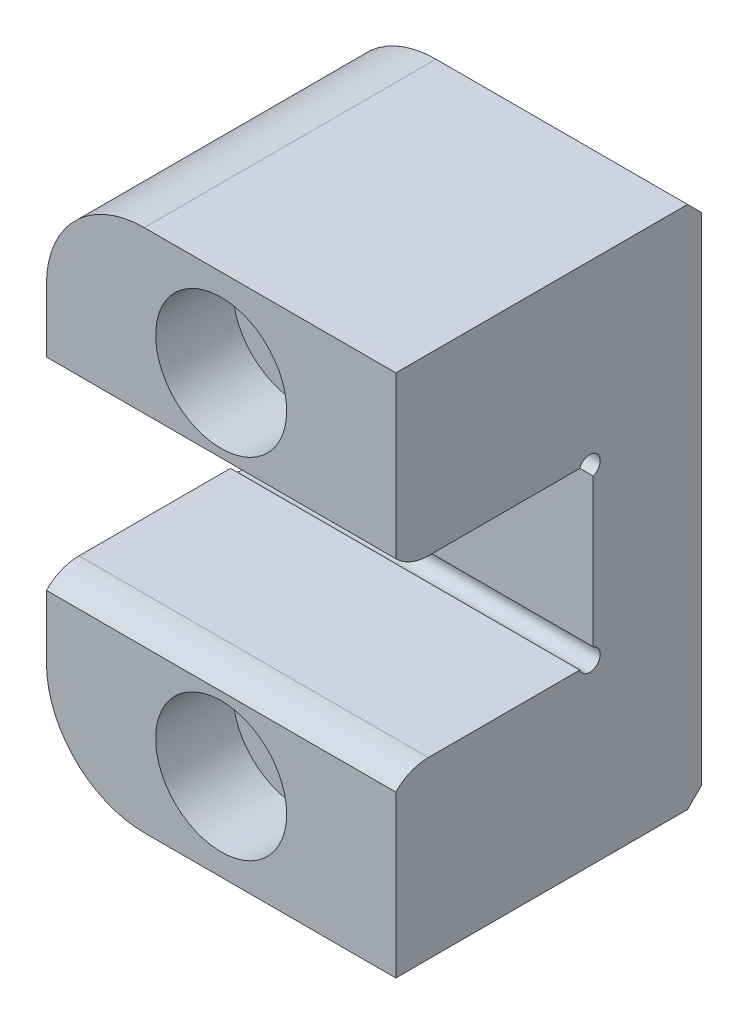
SolidWorks part; units mm, degrees
ref_plane "Front Plane" through (0, 0, 0) normal (0, 0, 1) x (1, 0, 0)
ref_plane "Top Plane" through (0, 0, 0) normal (0, 1, 0) x (1, 0, 0)
ref_plane "Right Plane" through (0, 0, 0) normal (1, 0, 0) x (0, 0, -1)
sketch "Sketch1" plane through (0, 0, 0) normal (1, 0, 0) x (0, 0, -1)
  line L0 (0, 0) -> (50000, 0) construction
  line L1 (0, 6.35) -> (14.351, 6.35)
  line L2 (0, 19.05) -> (22.225, 19.05)
  line L3 (0, 19.05) -> (0, 6.35)
  line L4 (0, -19.05) -> (22.225, -19.05)
  line L5 (22.225, 19.05) -> (22.225, -19.05)
  line L6 (14.351, 6.35) -> (14.351, -6.35)
  line L7 (14.351, -6.35) -> (0, -6.35)
  line L9 (0, 10.4775) -> (0, -10.4775) construction
  line L10 (0, -6.35) -> (0, -19.05)
  dimension "D1" = 22.225
  dimension "D2" = 38.1
  dimension "D3" = 14.351
  dimension "D4" = 12.7
extrude "Extrude1" add sketch "Sketch1" along normal mid plane 25.4
fillet "Fillet1" radius 7.112 2 edges at (-12.7, -19.05, -11.1125) (-12.7, 19.05, -11.1125)
sketch "Sketch2" plane through (-9.525, 0, -22.225) normal (0, 0, 1) x (1, 0, 0)
  line L0 (0, 0) -> (50000, 0) construction
  line L1 (22.225, -19.05) -> (22.225, 19.05) construction
  line L2 (20.6375, 3.846) -> (23.8125, 5.679) construction
  line L3 (20.6375, 3.846) -> (20.6375, -3.846) construction
  line L4 (20.6375, -3.846) -> (23.8125, -5.679) construction
  line L5 (23.8125, 5.679) -> (23.8125, -5.679) construction
  line L6 (9.525, 0) -> (9.525, 50000) construction
  line L7 (-4.7625, 5.679) -> (-4.7625, -5.679)
  line L8 (-1.5875, -3.846) -> (-4.7625, -5.679)
  line L9 (-1.5875, 3.846) -> (-1.5875, -3.846)
  line L10 (-1.5875, 3.846) -> (-4.7625, 5.679)
  point P4 (22.225, 4.7625)
  point P10 (22.225, -4.7625)
  point P13 (-3.175, -4.7625)
  point P14 (-3.175, 4.7625)
  dimension "D1" = 9.525
  dimension "D2" = 1.5875
  dimension "D3" = 30
  dimension "D4" = 3.175
extrude "Cut-Extrude1" cut sketch "Sketch2" along normal through all
sketch "Sketch5" plane through (12.7, 0, 0) normal (1, 0, 0) x (0, 0, -1)
  line L0 (0, 0) -> (50000, 0) construction
  line L1 (0, 6.35) -> (14.351, 6.35) construction
  line L2 (0, 19.05) -> (0, 6.35) construction
  line L3 (0, -6.35) -> (0, -19.05) construction
  line L4 (-3.9878, -4.171) -> (2.3622, -4.171)
  line L5 (-3.9878, -4.171) -> (-3.9878, -7.346)
  line L6 (-3.9878, -7.346) -> (0, -7.346)
  line L7 (2.3622, -4.171) -> (2.3622, -6.35)
  line L8 (14.351, -6.35) -> (0, -6.35) construction
  line L9 (2.3622, 4.171) -> (2.3622, 6.35)
  line L10 (-3.9878, 7.346) -> (0, 7.346)
  line L11 (-3.9878, 4.171) -> (-3.9878, 7.346)
  line L12 (-3.9878, 4.171) -> (2.3622, 4.171)
  arc A0 (0.5438, -6.6159) -> (2.3622, -6.35) centre (2.3622, -12.7) cw construction
  arc A1 (0, -7.346) -> (0.5438, -6.6159) centre (0.762, -7.346) cw construction
  arc A2 (0, 7.346) -> (0.5438, 6.6159) centre (0.762, 7.346) ccw construction
  arc A3 (0.5438, 6.6159) -> (2.3622, 6.35) centre (2.3622, 12.7) ccw construction
  arc A4 (0, 7.346) -> (2.3622, 6.35) centre (2.3622, 9.6492) ccw
  arc A5 (0, -7.346) -> (2.3622, -6.35) centre (2.3622, -9.6492) cw
  dimension "D1" = 0.762
  dimension "D2" = 6.35
  dimension "D3" = 3.175
  dimension "D4" = 6.35
  dimension "D5" = 2.3622
extrude "Cut-Extrude2" cut sketch "Sketch5" against normal through all
sketch "Sketch6" plane through (12.7, 0, 0) normal (1, 0, 0) x (0, 0, -1)
  line L0 (0, 0) -> (50000, 0) construction
  line L3 (14.351, 6.35) -> (14.351, -6.35) construction
  line L4 (2.3622, 6.35) -> (14.351, 6.35) construction
  circle A0 centre (14.097, 6.096) radius 0.762
  circle A1 centre (14.097, -6.096) radius 0.762
  dimension "D2" = 0.508
  dimension "D3" = 0.762
  dimension "D1" = 0.508
extrude "Cut-Extrude3" cut sketch "Sketch6" against normal through all
hole_wizard "#10 CBORE" positions "Sketch4" profile "Sketch3" counterbore size "#10" standard "Ansi Inch"
sketch "Sketch4" plane through (0, 0, 0) normal (0, 0, 1) x (1, 0, 0)
  line L0 (0, 0) -> (0, 50000) construction
  line L1 (0, 0) -> (50000, 0) construction
  point P0 (0, 12.7)
  point P12 (0, -12.7)
  dimension "D1" = 25.4
sketch "Sketch3" plane through (0, 12.7, 0) normal (1, 0, 0) x (0, -1, 0)
  line L0 (0, 0) -> (0, 22.225)
  line L1 (0, 22.225) -> (2.8067, 22.225)
  line L3 (2.8067, 22.225) -> (2.8067, 5.6197)
  line L4 (2.8067, 5.6197) -> (4.7625, 5.6197)
  line L5 (4.7625, 5.6197) -> (4.7625, 0)
  line L7 (4.7625, 0) -> (0, 0)
  line L11 (0, -6.35) -> (0, 107.95) construction
  dimension "Thru Hole Dia." = 5.6134
  dimension "Thru Hole Depth" = 22.225
  dimension "C'Bore Dia." = 9.525
  dimension "C'Bore Depth" = 5.6197
chamfer "Chamfer3" distance 3.81 angle 15 1 edges at (-11.1125, 0, -14.351)
chamfer "Chamfer1" distance 1.016 angle 45 6 edges at (-12.7, -8.3502, -22.225) (-10.6169, -16.9669, -22.225) (3.556, -19.05, -22.225) (3.556, 19.05, -22.225) (-12.7, 8.3503, -22.225) (-10.6169, 16.9669, -22.225)
